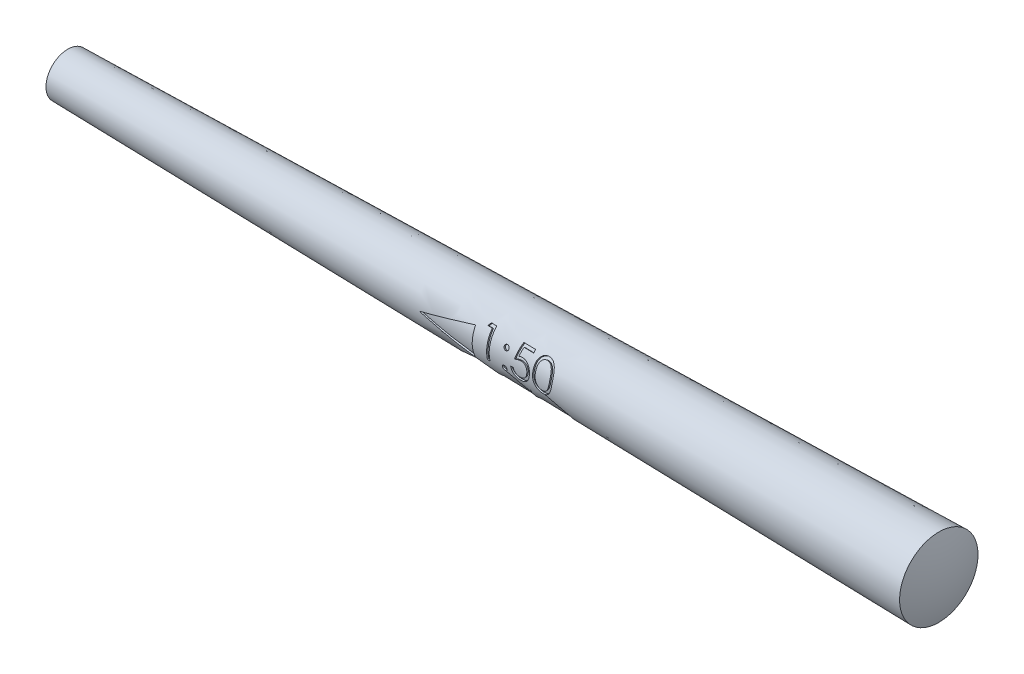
SolidWorks part; units mm, degrees
ref_plane "Front Plane" through (0, 0, 0) normal (0, 0, 1) x (1, 0, 0)
ref_plane "Top Plane" through (0, 0, 0) normal (0, 1, 0) x (1, 0, 0)
ref_plane "Right Plane" through (0, 0, 0) normal (1, 0, 0) x (0, 0, -1)
sketch "Sketch1" plane through (0, 0, 0) normal (1, 0, 0) x (0, 0, -1)
  circle A0 centre (0, 0) radius 0.75
  dimension "D1" = 1.5
extrude "Extrude1" add sketch "Sketch1" along normal mid plane 30
draft "Draft1" type of draft neutral plane draft angle 1.146 faces to draft 1 parameters "D1"=1.146
sketch "Sketch2" plane through (0, 0, 0) normal (0, 0, 1) x (1, 0, 0)
  line L0 (-15, 0) -> (-15, 0.75)
  line L1 (-15, 0.75) -> (-15, -0.75) construction
  line L2 (-15, 0) -> (-15.23, 0)
  line L3 (-15.23, 0) -> (-15.23, -1.05) construction
  line L4 (15, 0) -> (15, 1.35)
  line L5 (15, -1.35) -> (15, 1.35) construction
  line L6 (15, 0) -> (15.23, 0)
  line L7 (15.23, 0) -> (15.23, -1.05) construction
  line L8 (-15, -0.75) -> (15, -1.35) construction
  arc A0 (-15.23, 0) -> (-15, 0.75) centre (-13.8922, 0) cw
  arc A1 (15.23, 0) -> (15, 1.35) centre (11.1529, 0) ccw
  point P14 (0, -1.05)
revolve "Revolve1" add sketch "Sketch2" angle 360 about L2
sketch "Sketch5" plane through (0, 0, 0) normal (0, 0, 1) x (1, 0, 0)
  line L0 (0, 1.05) -> (0, -1.05) construction
  line L1 (15, 1.35) -> (-15, 0.75) construction
  line L2 (-15, -0.75) -> (15, -1.35) construction
ref_plane "Plane2" through (0, 0, 0) normal (-0.02, 0, 0.9998) x (0.9998, 0, 0.02)
sketch "Sketch6" plane through (0, 0, 0) normal (-0.02, 0, 0.9998) x (0.9998, 0, 0.02)
  line L0 (0, 0) -> (0, 0.5)
  line L1 (0, 1.05) -> (0, -1.05) construction
  line L2 (0, 0.5) -> (-1.866, 0)
  line L3 (-1.866, 0) -> (0, -0.5)
  line L4 (0, -0.5) -> (0, 0)
  line L5 (0, -0.25) -> (3, -0.25) construction
  text T0 "1:50" font "Century Gothic" height 1
  dimension "D1" = 1
  dimension "D2" = 30
  dimension "D3" = 3
wrap "Wrap2" sketch "Sketch6" wrap type deboss source sketch "Sketch6" thickness 0.05 parameters "D1"=0.05
equation "\"D2@Sketch2\" = \"D1@Sketch2\""
